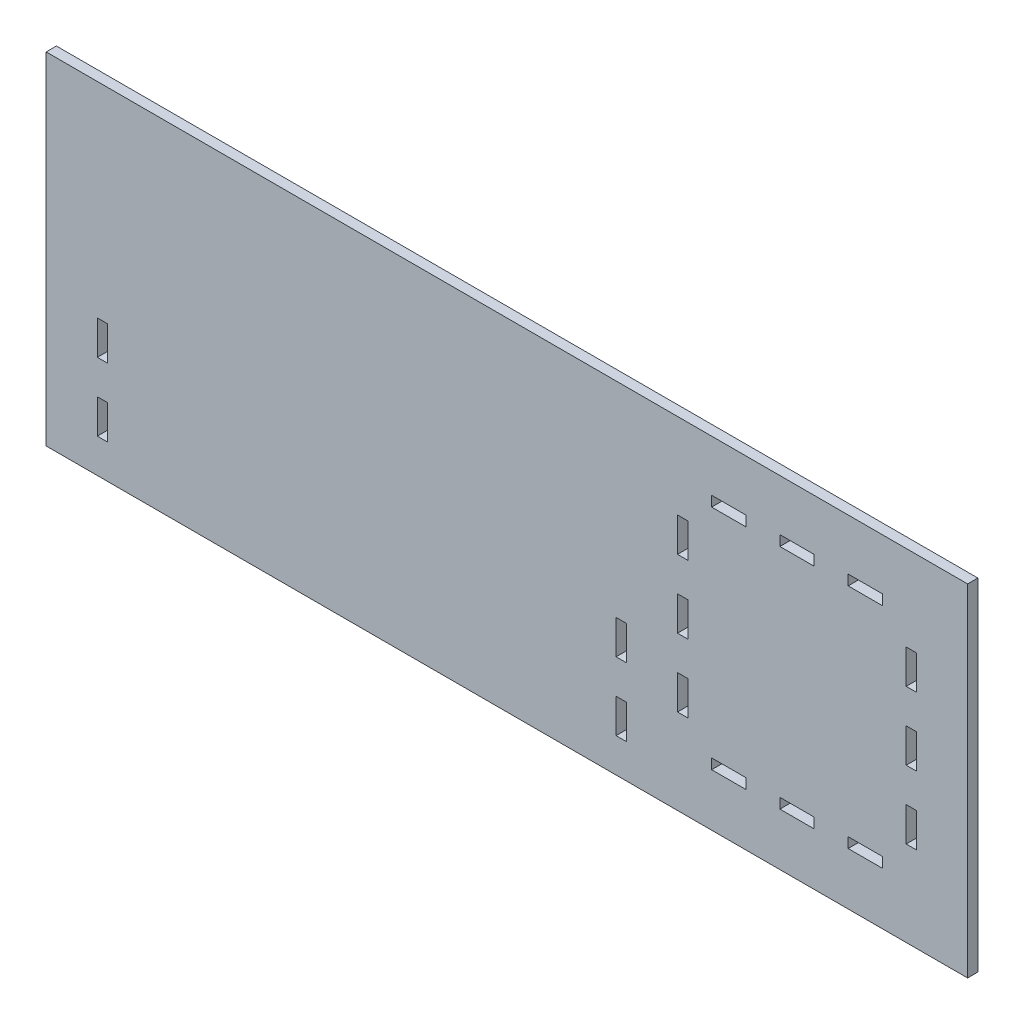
SolidWorks part; units mm, degrees
ref_plane "Front Plane" through (0, 0, 0) normal (0, 0, 1) x (1, 0, 0)
ref_plane "Top Plane" through (0, 0, 0) normal (0, 1, 0) x (1, 0, 0)
ref_plane "Right Plane" through (0, 0, 0) normal (1, 0, 0) x (0, 0, -1)
sketch "Sketch1" plane through (0, 0, 0) normal (0, 0, 1) x (1, 0, 0)
  line L1 (-135, 50) -> (135, 50)
  line L2 (-135, 50) -> (-135, -50)
  line L3 (-135, -50) -> (135, -50)
  line L4 (135, 50) -> (135, -50)
  line L5 (-135, 50) -> (135, -50) construction
  line L6 (-135, -50) -> (135, 50) construction
  point P0 (0, 0)
extrude "Boss-Extrude2" add sketch "Sketch1" along normal blind 3
sketch "Sketch3" plane through (0, 0, 3) normal (0, 0, 1) x (1, 0, 0)
  line L0 (135, 50) -> (135, 35) construction
  line L1 (135, -50) -> (135, 50) construction
  line L2 (135, 35) -> (120, 35) construction
  line L3 (117, -5) -> (117, 5)
  line L4 (80, 35) -> (90, 35)
  line L5 (50, 5) -> (53, 5)
  line L6 (80, -31.6464) -> (90, -31.6464)
  line L7 (50, 35) -> (60, 35) construction
  line L8 (60, 35) -> (70, 35)
  line L9 (60, 35) -> (60, 32)
  line L10 (60, 32) -> (70, 32)
  line L11 (70, 35) -> (70, 32)
  line L12 (60, 35) -> (70, 32) construction
  line L13 (60, 32) -> (70, 35) construction
  line L14 (80, 35) -> (80, 32)
  line L15 (80, 32) -> (90, 32)
  line L16 (90, 35) -> (90, 32)
  line L17 (100, 35) -> (110, 35)
  line L18 (100, 35) -> (100, 32)
  line L19 (100, 32) -> (110, 32)
  line L20 (110, 35) -> (110, 32)
  line L21 (60, 35) -> (80, 35) construction
  line L22 (50, 35) -> (50, 25) construction
  line L23 (50, 25) -> (53, 25)
  line L24 (50, 25) -> (50, 15)
  line L25 (50, 15) -> (53, 15)
  line L26 (53, 25) -> (53, 15)
  line L27 (50, 25) -> (53, 15) construction
  line L28 (50, 15) -> (53, 25) construction
  line L29 (50, 5) -> (50, -5)
  line L30 (53, 5) -> (53, -5)
  line L31 (50, -5) -> (53, -5)
  line L32 (50, -15) -> (53, -15)
  line L33 (50, -15) -> (50, -25)
  line L34 (53, -15) -> (53, -25)
  line L35 (50, -25) -> (53, -25)
  line L36 (50, 25) -> (50, 5) construction
  line L37 (50.0063, -35) -> (60, -34.6464) construction
  line L38 (60, -34.6464) -> (70, -34.6464)
  line L39 (60, -34.6464) -> (60, -31.6464)
  line L40 (60, -31.6464) -> (70, -31.6464)
  line L41 (70, -34.6464) -> (70, -31.6464)
  line L42 (60, -34.6464) -> (70, -31.6464) construction
  line L43 (60, -31.6464) -> (70, -34.6464) construction
  line L44 (80, -34.6464) -> (80, -31.6464)
  line L45 (90, -34.6464) -> (90, -31.6464)
  line L46 (80, -34.6464) -> (90, -34.6464)
  line L47 (100, -31.6464) -> (110, -31.6464)
  line L48 (100, -34.6464) -> (100, -31.6464)
  line L49 (110, -34.6464) -> (110, -31.6464)
  line L50 (100, -34.6464) -> (110, -34.6464)
  line L51 (60, -31.6464) -> (80, -31.6464) construction
  line L52 (120, -35) -> (120, -25) construction
  line L53 (120, -25) -> (117, -25)
  line L54 (120, -25) -> (120, -15)
  line L55 (120, -15) -> (117, -15)
  line L56 (117, -25) -> (117, -15)
  line L57 (120, -25) -> (117, -15) construction
  line L58 (120, -15) -> (117, -25) construction
  line L59 (120, 5) -> (117, 5)
  line L60 (120, -5) -> (120, 5)
  line L61 (120, -5) -> (117, -5)
  line L62 (117, 15) -> (117, 25)
  line L63 (120, 25) -> (117, 25)
  line L64 (120, 15) -> (120, 25)
  line L65 (120, 15) -> (117, 15)
  line L66 (117, -25) -> (117, -5) construction
  point P13 (65, 33.5)
  point P28 (51.5, 20)
  point P43 (65, -33.1464)
  point P58 (118.5, -20)
extrude "Cut-Extrude3" cut sketch "Sketch3" against normal blind 3
sketch "Sketch5" plane through (0, 0, 3) normal (0, 0, 1) x (1, 0, 0)
  line L0 (50, -25) -> (35, -25) construction
  line L1 (-120, 0) -> (-120, -10) construction
  line L2 (35, -50) -> (35, 0) construction
  line L3 (-135, -50) -> (135, -50) construction
  line L4 (-135, 0) -> (-120, 0) construction
  line L5 (-120, -30) -> (-117, -30)
  line L6 (-135, 50) -> (-135, -50) construction
  line L7 (-120, -10) -> (-117, -10)
  line L8 (-120, -10) -> (-120, -20)
  line L9 (-120, -20) -> (-117, -20)
  line L10 (-117, -10) -> (-117, -20)
  line L11 (-120, -10) -> (-117, -20) construction
  line L12 (-120, -20) -> (-117, -10) construction
  line L13 (-120, -30) -> (-120, -40)
  line L14 (-117, -30) -> (-117, -40)
  line L15 (-120, -40) -> (-117, -40)
  line L16 (-120, -10) -> (-120, -30) construction
  point P16 (-118.5, -15)
extrude "Cut-Extrude4" cut sketch "Sketch5" against normal blind 3
sketch "Sketch6" plane through (0, 0, 3) normal (0, 0, 1) x (1, 0, 0)
  line L0 (35, -40) -> (32, -40)
  line L1 (35, -50) -> (35, 50) construction
  line L2 (-135, -50) -> (135, -50) construction
  line L3 (135, 50) -> (-135, 50) construction
  line L4 (35, 0) -> (35, -10) construction
  line L5 (35, -10) -> (32, -10)
  line L6 (35, -10) -> (35, -20)
  line L7 (35, -20) -> (32, -20)
  line L8 (32, -10) -> (32, -20)
  line L9 (35, -10) -> (32, -20) construction
  line L10 (35, -20) -> (32, -10) construction
  line L11 (32, -30) -> (32, -40)
  line L12 (35, -30) -> (32, -30)
  line L13 (35, -30) -> (35, -40)
  line L14 (35, -20) -> (35, -40) construction
  point P12 (33.5, -15)
extrude "Cut-Extrude5" cut sketch "Sketch6" against normal blind 3
equation "\"length\"= 270mm"
equation "\"width\"= 100mm"
equation "\"height\"= 3mm"
equation "\"finger_l\"= 10mm"
equation "\"finger_w\"= 3mm"
equation "\"D1@Sketch1\"=\"length\""
equation "\"D2@Sketch1\"=\"width\""
equation "\"D1@Boss-Extrude2\"=\"height\""
equation "\"D7@Sketch3\"=\"finger_l\""
equation "\"D8@Sketch3\"=\"finger_w\""
equation "\"D11@Sketch3\"=\"finger_w\""
equation "\"D12@Sketch3\"=\"finger_l\""
equation "\"D15@Sketch3\"=\"finger_l\""
equation "\"D16@Sketch3\"=\"finger_w\""
equation "\"D19@Sketch3\"=\"finger_w\""
equation "\"D20@Sketch3\"=\"finger_l\""
equation "\"D1@Cut-Extrude3\"=\"height\""
equation "\"D4@Sketch5\"=\"finger_l\""
equation "\"D5@Sketch5\"=\"finger_w\""
equation "\"D1@Cut-Extrude4\"=\"height\""
equation "\"D1@Sketch6\"=\"finger_w\""
equation "\"D3@Sketch6\"=\"finger_l\""
equation "\"D1@Cut-Extrude5\"=\"height\""
